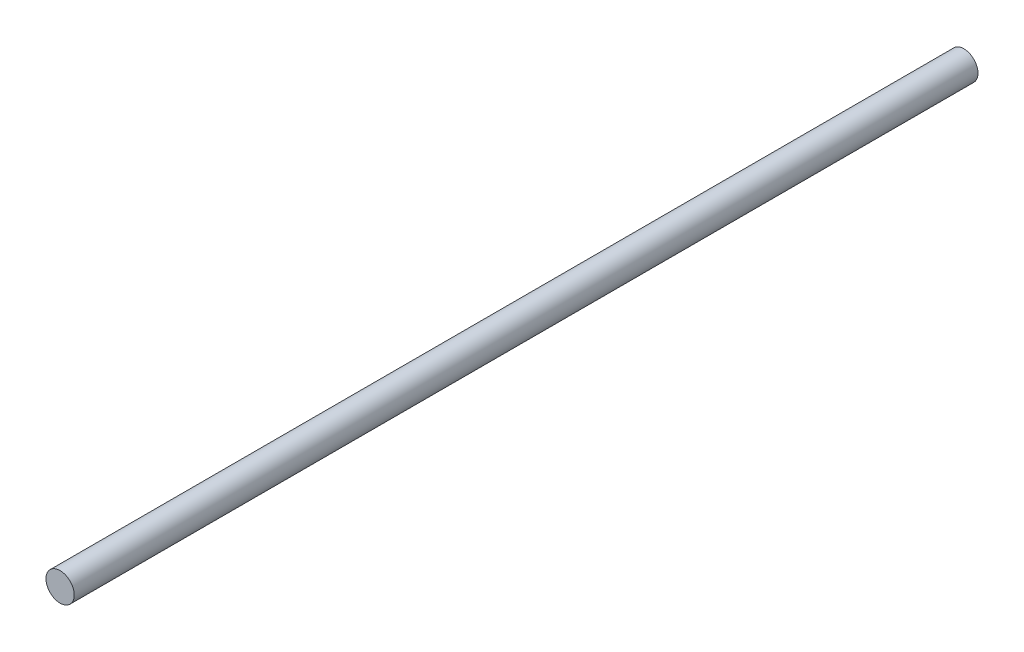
SolidWorks part; units mm, degrees
ref_plane "Front Plane" through (0, 0, 0) normal (0, 0, 1) x (1, 0, 0)
ref_plane "Top Plane" through (0, 0, 0) normal (0, 1, 0) x (1, 0, 0)
ref_plane "Right Plane" through (0, 0, 0) normal (1, 0, 0) x (0, 0, -1)
sketch "Sketch1" plane through (0, 0, 0) normal (0, 0, 1) x (1, 0, 0)
  circle A0 centre (0, 0) radius 0.7937
  dimension "D1" = 1.5875
extrude "Boss-Extrude1" add sketch "Sketch1" along normal blind 50.8
